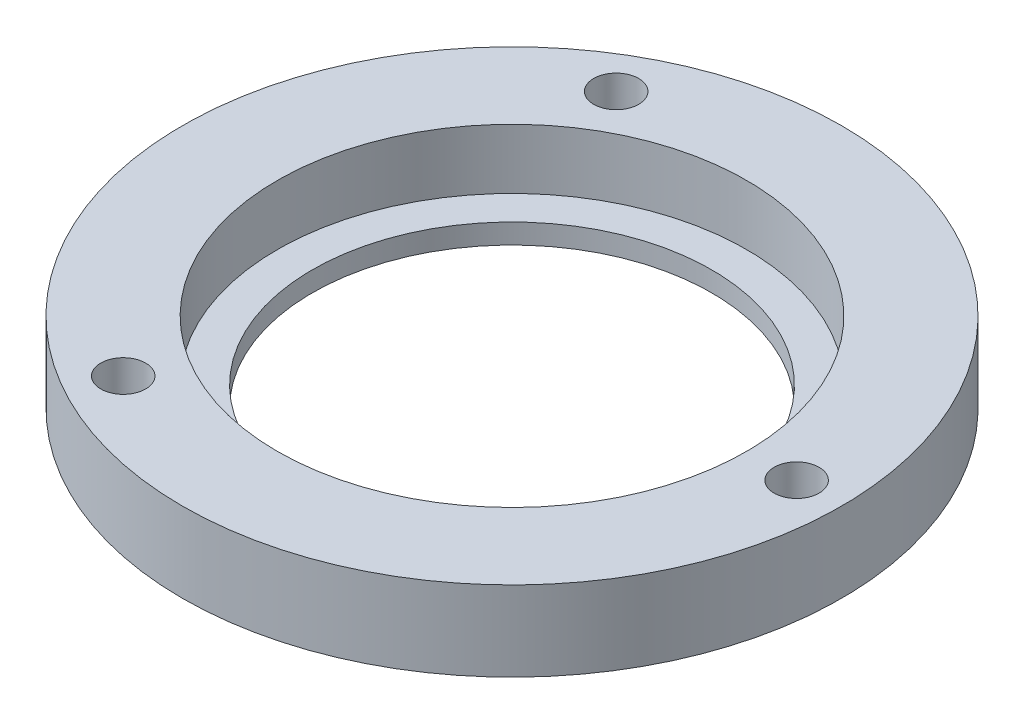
SolidWorks part; units mm, degrees
ref_plane "Plan de face" through (0, 0, 0) normal (0, 0, 1) x (1, 0, 0)
ref_plane "Plan de dessus" through (0, 0, 0) normal (0, 1, 0) x (1, 0, 0)
ref_plane "Plan de droite" through (0, 0, 0) normal (1, 0, 0) x (0, 0, -1)
sketch "Esquisse1" plane through (0, 0, 0) normal (0, 0, 1) x (1, 0, 0)
  line L0 (0, 31.1775) -> (0, -18.2019) construction
  line L1 (20, 2) -> (20, 0)
  line L2 (20, 0) -> (33, 0)
  line L3 (33, 0) -> (33, 8)
  line L4 (33, 8) -> (23.5, 8)
  line L5 (23.5, 8) -> (23.5, 2)
  line L6 (23.5, 2) -> (20, 2)
  dimension "D1" = 40
  dimension "D2" = 47
  dimension "D3" = 66
  dimension "D4" = 2
  dimension "D5" = 8
revolve "Révolution1" add sketch "Esquisse1" angle 360 about L0
hole_wizard "Chambrage pour vis à tête cylindrique à 6 pans creux (ou vis CHC) M41" positions "Esquisse3" profile "Esquisse2" counterbore size "M4" standard "Ansi Métrique"
sketch "Esquisse3" plane through (0, 0, 0) normal (0, -1, 0) x (1, 0, 0)
  point P0 (28.5, 0)
  dimension "D1" = 28.5
sketch "Esquisse2" plane through (28.5, 0, 0) normal (1, 0, 0) x (0, 0, -1)
  line L0 (0, 0) -> (0, 8)
  line L1 (0, 8) -> (2.25, 8)
  line L3 (2.25, 8) -> (2.25, 4)
  line L4 (2.25, 4) -> (4, 4)
  line L5 (4, 4) -> (4, 0)
  line L7 (4, 0) -> (0, 0)
  line L11 (0, -6.35) -> (0, 107.95) construction
  dimension "Diamètre du perçage jusqu'au prochain" = 4.5
  dimension "Profondeur du perçage jusqu'au prochain" = 8
  dimension "Diamètre du chambrage" = 8
  dimension "Profondeur du chambrage" = 4
pattern_circular "Répétition circulaire1" count 3 every 120 about axis through (0, 0, 0) along (0, 1, 0) of "Chambrage pour vis à tête cylindrique à 6 pans creux (ou vis CHC) M41"
